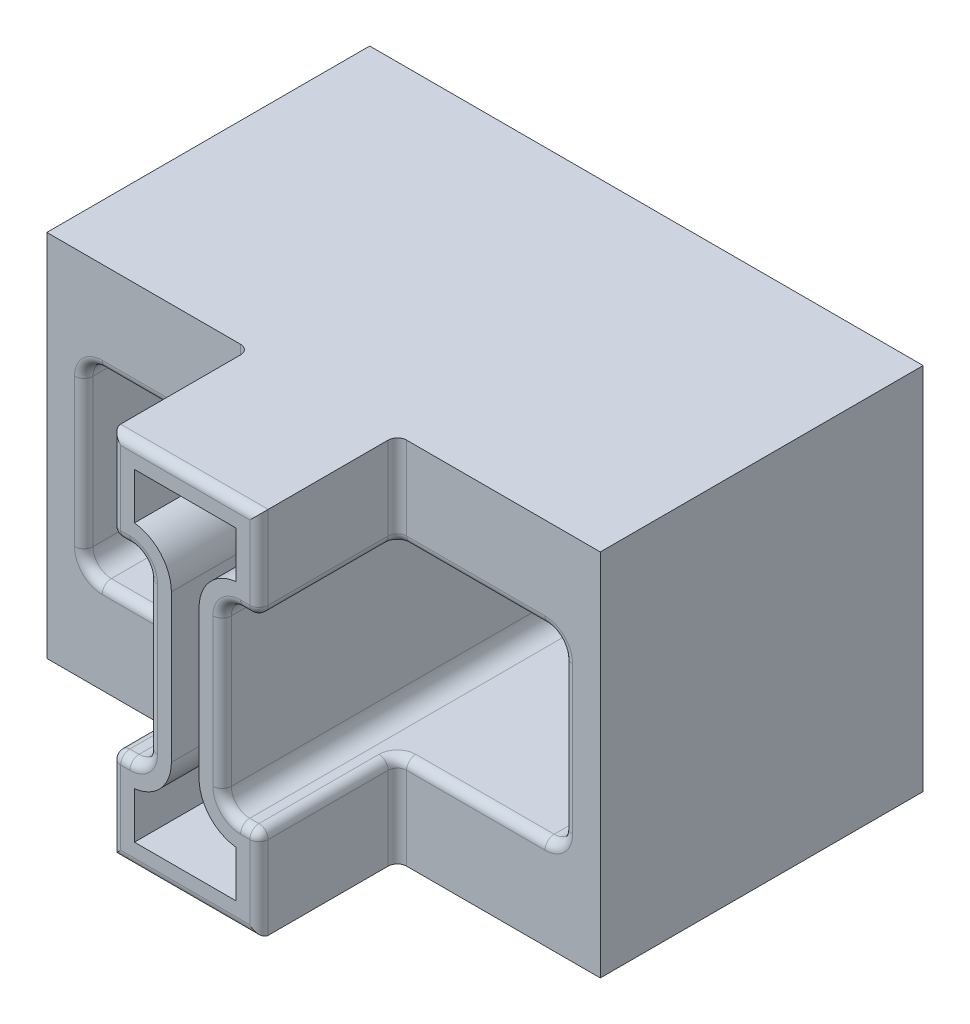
SolidWorks part; units mm, degrees
ref_plane "Front" through (0, 0, 0) normal (0, 0, 1) x (1, 0, 0)
ref_plane "Top" through (0, 0, 0) normal (0, 1, 0) x (1, 0, 0)
ref_plane "Right" through (0, 0, 0) normal (1, 0, 0) x (0, 0, -1)
imported_body "Imported1"
sketch "Sketch1" plane through (0, 0, 63.5) normal (0, 0, 1) x (1, 0, 0)
  line L24 (36.195, 35.56) -> (36.195, 15.24)
  line L25 (31.115, 9.5604) -> (31.115, 3.175)
  line L26 (31.115, 3.175) -> (45.085, 3.175)
  line L27 (45.085, 3.175) -> (45.085, 9.5604)
  line L28 (40.005, 15.24) -> (40.005, 35.56)
  line L29 (45.085, 41.2396) -> (45.085, 47.625)
  line L30 (45.085, 47.625) -> (31.115, 47.625)
  line L31 (31.115, 47.625) -> (31.115, 41.2396)
  line L32 (36.195, 35.56) -> (36.195, 15.24)
  line L33 (31.115, 9.5604) -> (31.115, 3.175)
  line L34 (31.115, 3.175) -> (45.085, 3.175)
  line L35 (45.085, 3.175) -> (45.085, 9.5604)
  line L36 (40.005, 15.24) -> (40.005, 35.56)
  line L37 (45.085, 41.2396) -> (45.085, 47.625)
  line L38 (45.085, 47.625) -> (31.115, 47.625)
  line L39 (31.115, 47.625) -> (31.115, 41.2396)
  arc A8 (31.115, 9.5604) -> (36.195, 15.24) centre (30.48, 15.24) ccw
  arc A9 (40.005, 15.24) -> (45.085, 9.5604) centre (45.72, 15.24) ccw
  arc A10 (45.085, 41.2396) -> (40.005, 35.56) centre (45.72, 35.56) ccw
  arc A11 (36.195, 35.56) -> (31.115, 41.2396) centre (30.48, 35.56) ccw
  arc A12 (31.115, 9.5604) -> (36.195, 15.24) centre (30.48, 15.24) ccw
  arc A13 (40.005, 15.24) -> (45.085, 9.5604) centre (45.72, 15.24) ccw
  arc A14 (45.085, 41.2396) -> (40.005, 35.56) centre (45.72, 35.56) ccw
  arc A15 (36.195, 35.56) -> (31.115, 41.2396) centre (30.48, 35.56) ccw
  dimension "D1" = 1.905
extrude "Cut-Extrude1" cut sketch "Sketch1" against normal blind 63.5
